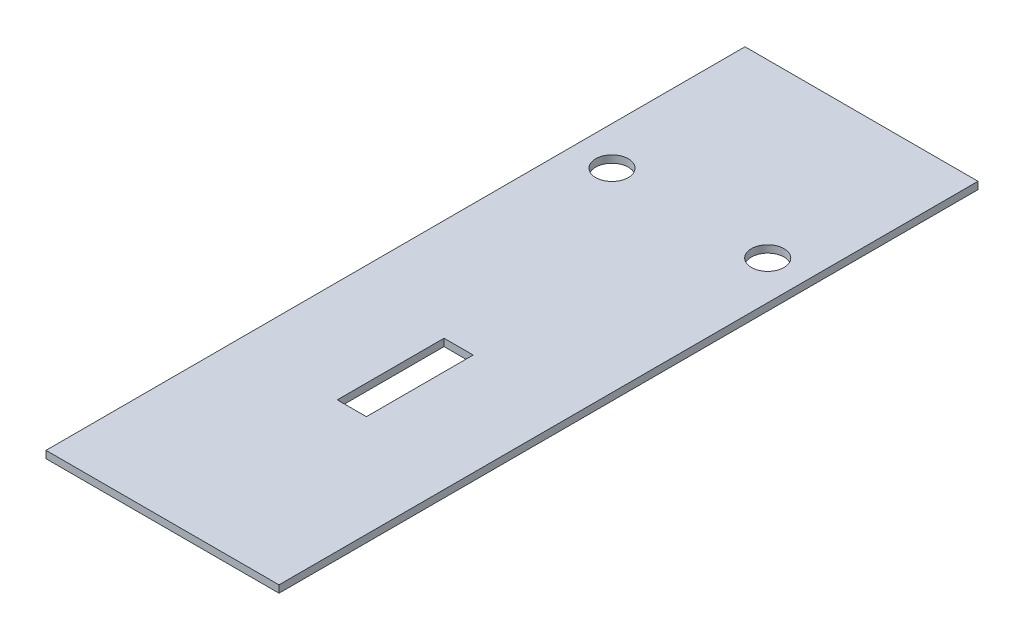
SolidWorks part; units mm, degrees
ref_plane "Front Plane" through (0, 0, 0) normal (0, 0, 1) x (1, 0, 0)
ref_plane "Top Plane" through (0, 0, 0) normal (0, 1, 0) x (1, 0, 0)
ref_plane "Right Plane" through (0, 0, 0) normal (1, 0, 0) x (0, 0, -1)
sketch "Sketch1" plane through (0, 0, 0) normal (0, 1, 0) x (1, 0, 0)
  line L1 (-76.2, -228.6) -> (76.2, -228.6)
  line L2 (-76.2, -228.6) -> (-76.2, 228.6)
  line L3 (-76.2, 228.6) -> (76.2, 228.6)
  line L4 (76.2, -228.6) -> (76.2, 228.6)
  line L5 (-76.2, -228.6) -> (76.2, 228.6) construction
  line L6 (-76.2, 228.6) -> (76.2, -228.6) construction
  point P0 (0, 0)
  dimension "D1" = 152.4
  dimension "D2" = 457.2
extrude "Boss-Extrude1" add sketch "Sketch1" along normal blind 4.7625
sketch "Sketch2" plane through (0, 0, 0) normal (0, 1, 0) x (1, 0, 0)
  line L0 (-76.2, -228.6) -> (76.2, -228.6) construction
  line L1 (-9.525, -34.925) -> (9.525, -34.925)
  line L2 (-9.525, -34.925) -> (-9.525, -104.775)
  line L3 (-9.525, -104.775) -> (9.525, -104.775)
  line L4 (9.525, -34.925) -> (9.525, -104.775)
  line L5 (-50.927, 116.332) -> (50.927, 116.332) construction
  line L7 (-50.927, 127) -> (50.927, 127) construction
  line L8 (76.2, 228.6) -> (-76.2, 228.6) construction
  circle A0 centre (-50.927, 116.332) radius 10.668
  circle A1 centre (50.927, 116.332) radius 10.668
  point P6 (0, -34.925)
  point P12 (0, 116.332)
  dimension "D4" = 21.336
  dimension "D1" = 123.825
  dimension "D2" = 69.85
  dimension "D3" = 19.05
  dimension "D5" = 101.854
  dimension "D6" = 101.6
extrude "Cut-Extrude3" cut sketch "Sketch2" along normal through all
